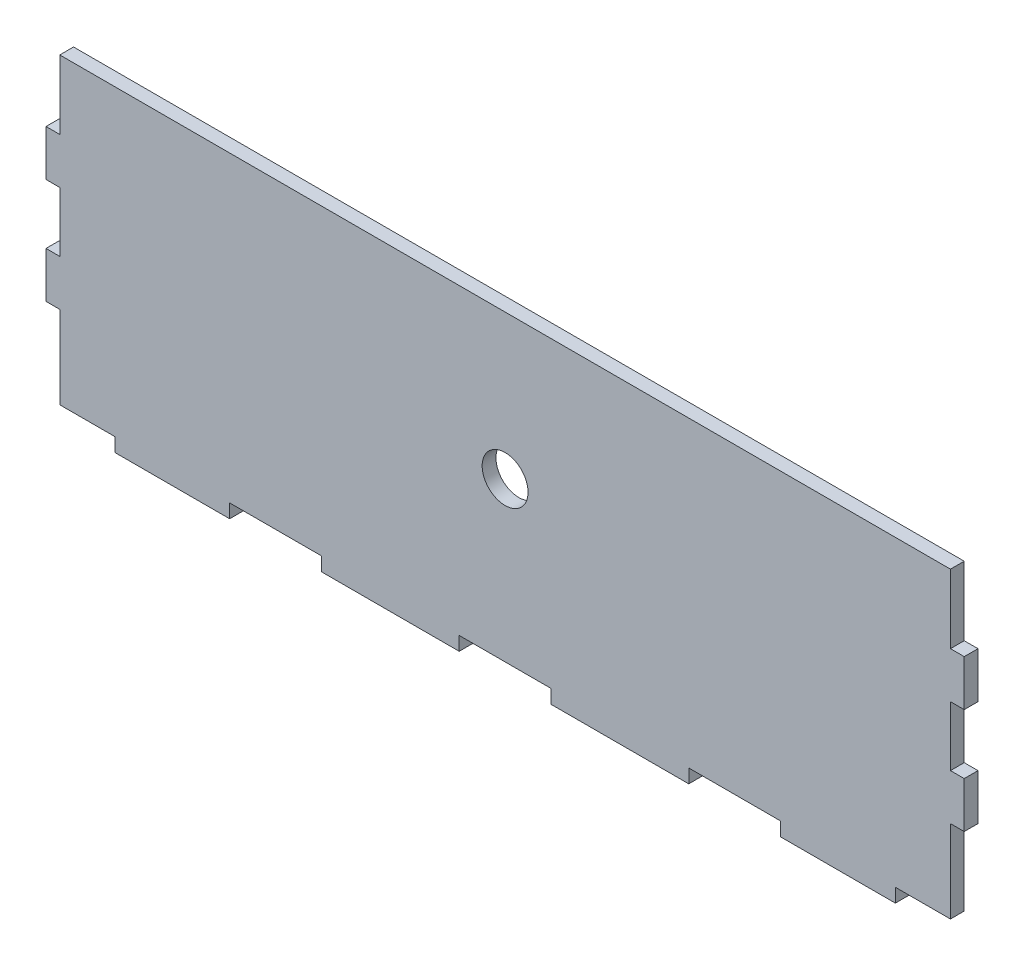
SolidWorks part; units mm, degrees
ref_plane "Alzado" through (0, 0, 0) normal (0, 0, 1) x (1, 0, 0)
ref_plane "Planta" through (0, 0, 0) normal (0, 1, 0) x (1, 0, 0)
ref_plane "Vista lateral" through (0, 0, 0) normal (1, 0, 0) x (0, 0, -1)
sketch "Croquis1" plane through (0, 0, 0) normal (0, 0, 1) x (1, 0, 0)
  line L1 (0, 0) -> (200, 0)
  line L2 (0, 0) -> (0, 75)
  line L3 (0, 75) -> (200, 75)
  line L4 (200, 0) -> (200, 75)
extrude "Saliente-Extruir1" add sketch "Croquis1" along normal blind 3
sketch "Croquis2" plane through (0, 0, 3) normal (0, 0, 1) x (1, 0, 0)
  line L0 (0, 75) -> (15, 75)
  line L1 (200, 75) -> (0, 75) construction
  line L4 (3, 69) -> (3, 54)
  line L5 (3, 3) -> (3, 21)
  line L10 (3, 21) -> (0, 21)
  line L15 (0, 75) -> (0, 0) construction
  line L22 (0, 21) -> (0, 0)
  line L23 (185, 75) -> (15, 75)
  line L25 (185, 3) -> (197, 3)
  line L26 (185, 0) -> (185, 3)
  line L27 (160, 3) -> (160, 0)
  line L28 (140, 0) -> (160, 0)
  line L29 (140, 3) -> (140, 0)
  line L30 (140, 3) -> (160, 3)
  line L31 (3, 54) -> (0, 54)
  line L32 (110, 3) -> (110, 0)
  line L33 (90, 0) -> (110, 0)
  line L34 (90, 3) -> (90, 0)
  line L35 (90, 3) -> (110, 3)
  line L36 (0, 54) -> (0, 75)
  line L37 (60, 3) -> (60, 0)
  line L38 (40, 0) -> (60, 0)
  line L39 (40, 3) -> (40, 0)
  line L40 (40, 3) -> (60, 3)
  line L41 (185, 75) -> (200, 75)
  line L42 (200, 75) -> (200, 54)
  line L43 (15, 3) -> (3, 3)
  line L44 (15, 0) -> (15, 3)
  line L45 (0, 0) -> (15, 0)
  line L46 (200, 0) -> (200, 75) construction
  line L47 (200, 54) -> (197, 54)
  line L48 (197, 54) -> (197, 69)
  line L49 (197, 21) -> (200, 21)
  line L50 (200, 21) -> (200, 0)
  line L51 (200, 0) -> (185, 0)
  line L52 (197, 21) -> (197, 3)
  line L56 (3, 44) -> (0, 44)
  line L57 (3, 44) -> (3, 31)
  line L58 (3, 31) -> (0, 31)
  line L59 (0, 44) -> (0, 31)
  line L60 (197, 31) -> (200, 31)
  line L61 (197, 31) -> (197, 44)
  line L62 (197, 44) -> (200, 44)
  line L63 (200, 31) -> (200, 44)
  line L77 (197, 69) -> (3, 69)
  circle A3 centre (100, 37.5) radius 5
extrude "Cortar-Extruir1" cut sketch "Croquis2" against normal blind 6
